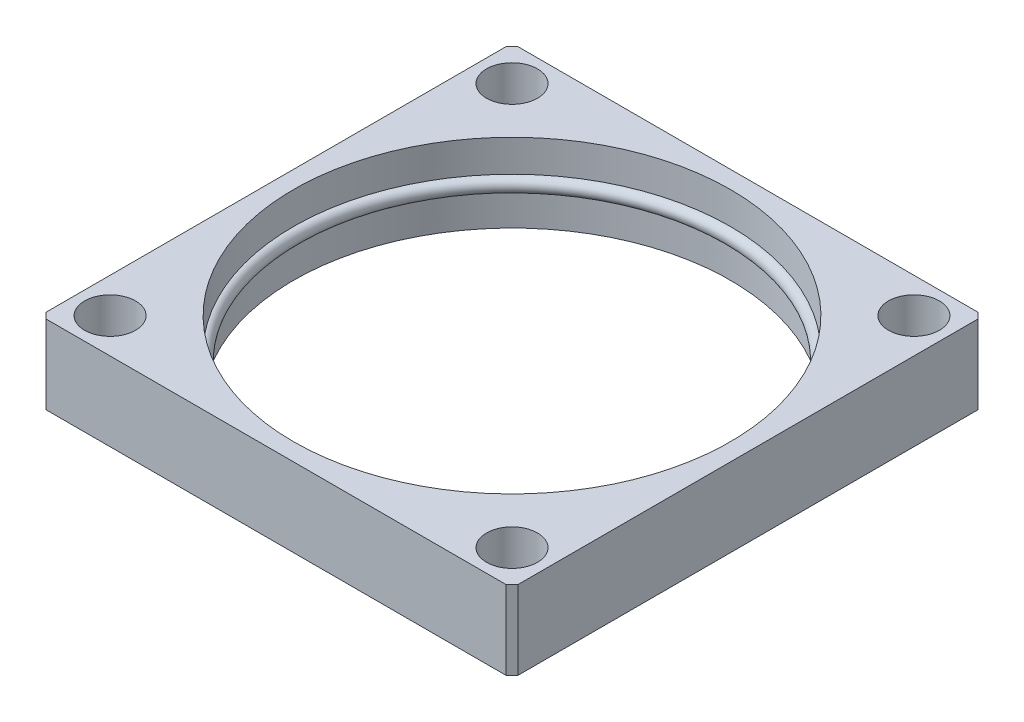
SolidWorks part; units mm, degrees
ref_plane "Front Plane" through (0, 0, 0) normal (0, 0, 1) x (1, 0, 0)
ref_plane "Top Plane" through (0, 0, 0) normal (0, 1, 0) x (1, 0, 0)
ref_plane "Right Plane" through (0, 0, 0) normal (1, 0, 0) x (0, 0, -1)
sketch "Sketch1" plane through (0, 0, 0) normal (0, 1, 0) x (1, 0, 0)
  line L0 (-81, 79) -> (-79, 81)
  line L1 (-79, -81) -> (79, -81)
  line L2 (-81, -79) -> (-81, 79)
  line L3 (-79, 81) -> (79, 81)
  line L4 (81, -79) -> (81, 79)
  line L5 (-81, -81) -> (81, 81) construction
  line L6 (-81, 81) -> (81, -81) construction
  line L7 (79, 81) -> (81, 79)
  line L8 (79, -81) -> (81, -79)
  line L9 (-79, -81) -> (-81, -79)
  line L10 (-69, 69) -> (-69, -69) construction
  line L15 (-69, -69) -> (69, -69) construction
  line L16 (69, -69) -> (69, 69) construction
  line L17 (69, 69) -> (-69, 69) construction
  circle A0 centre (0, 0) radius 75
  circle A1 centre (-69, 69) radius 8.75
  circle A2 centre (69, 69) radius 8.75
  circle A3 centre (69, -69) radius 8.75
  circle A4 centre (-69, -69) radius 8.75
  point P0 (0, 0)
  dimension "D2" = 150
  dimension "D4" = 17.5
  dimension "D1" = 162
  dimension "D3" = 138
extrude "Boss-Extrude1" add sketch "Sketch1" along normal mid plane 27
sketch "Sketch2" plane through (0, 0, 0) normal (0, 0, 1) x (1, 0, 0)
  line L0 (-75, 0) -> (0, 0) construction
  line L1 (0, 0) -> (0, 13.5) construction
  line L2 (-79, 13.5) -> (79, 13.5) construction
  circle A0 centre (-75, 0) radius 2.5
  dimension "D1" = 5
  dimension "D2" = 150
revolve "Revolve1" add sketch "Sketch2" angle 360 about L1
